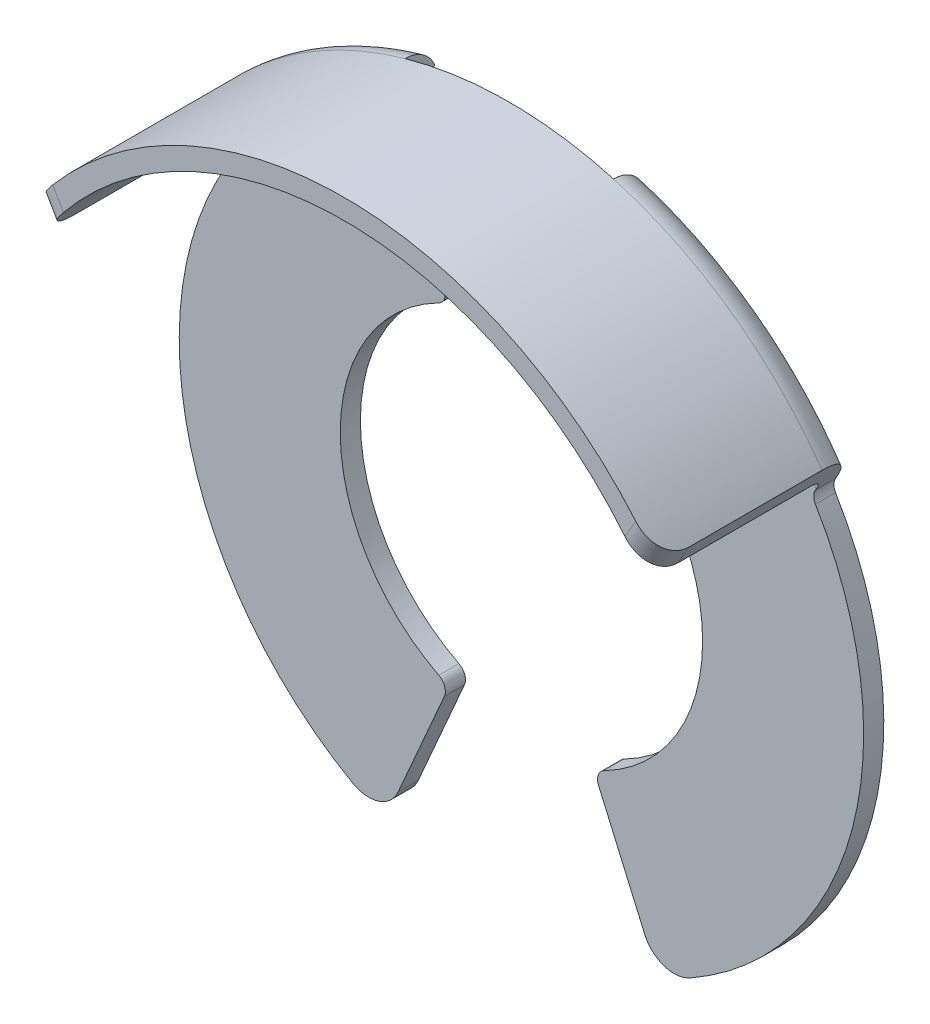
SolidWorks part; units mm, degrees
ref_plane "Front Plane" through (0, 0, 0) normal (0, 0, 1) x (1, 0, 0)
ref_plane "Top Plane" through (0, 0, 0) normal (0, 1, 0) x (1, 0, 0)
ref_plane "Right Plane" through (0, 0, 0) normal (1, 0, 0) x (0, 0, -1)
sketch "Sketch1" plane through (0, 0, 0) normal (0, 0, 1) x (1, 0, 0)
  circle A0 centre (0, 0) radius 9
  circle A1 centre (0, 0) radius 19
  dimension "D1" = 18
  dimension "D2" = 38
extrude "Boss-Extrude1" add sketch "Sketch1" against normal blind 9.8
sketch "Sketch2" plane through (0, 0, 0) normal (0, 0, 1) x (1, 0, 0)
  circle A0 centre (0, 0) radius 18
  dimension "D1" = 36
extrude "Cut-Extrude1" cut sketch "Sketch2" against normal blind 8.8
sketch "Sketch3" plane through (0, 0, 0) normal (0, 0, 1) x (1, 0, 0)
  line L0 (-15.5387, 10.9338) -> (-14.4222, 9)
  line L1 (15.5387, 10.9338) -> (14.4222, 9)
  circle A0 centre (0, 0) radius 19 construction
  arc A1 (-14.4222, 9) -> (14.4222, 9) centre (0, 0) ccw
  circle A2 centre (0, 0) radius 9 construction
  arc A4 (-15.5387, 10.9338) -> (15.5387, 10.9338) centre (0, 0) ccw
  point P7 (-17, 0)
  point P9 (17, 0)
  point P10 (0, 9)
  dimension "D1" = 60
  dimension "D2" = 34
extrude "Cut-Extrude2" cut sketch "Sketch3" against normal through all
sketch "Sketch4" plane through (0, 0, -8.8) normal (0, 0, 1) x (1, 0, 0)
  line L0 (0, 0) -> (-3.5978, -8.2496) construction
  line L1 (0, 0) -> (3.5978, -8.2496) construction
  line L2 (-3.5978, 8.2496) -> (-6.5247, 14.9609)
  line L3 (0, 0) -> (-3.5978, 8.2496) construction
  line L4 (0, 0) -> (3.5978, 8.2496) construction
  line L5 (6.5247, 14.9609) -> (3.5978, 8.2496)
  line L6 (3.5978, 8.2496) -> (3.5978, -8.2496) construction
  line L7 (-3.5978, 8.2496) -> (-3.5978, -8.2496) construction
  line L8 (-3.5978, -8.2496) -> (-6.1229, -14.0396)
  line L9 (3.5978, -8.2496) -> (6.1229, -14.0396)
  arc A0 (5.5515, 17.1225) -> (-5.5515, 17.1225) centre (0, 0) ccw
  arc A1 (14.9843, 9.9735) -> (-14.9843, 9.9735) centre (0, 0) ccw construction
  arc A2 (-3.5978, 8.2496) -> (-3.5978, -8.2496) centre (0, 0) ccw
  circle A3 centre (0, 0) radius 9 construction
  arc A4 (-6.5247, 14.9609) -> (-5.5515, 17.1225) centre (-5.0581, 15.6005) cw
  arc A6 (5.5515, 17.1225) -> (6.5247, 14.9609) centre (5.0581, 15.6005) cw
  arc A7 (-6.1229, -14.0396) -> (-8.378, -14.7922) centre (-7.5895, -13.4) cw
  arc A8 (-14.4222, 9) -> (14.4222, 9) centre (0, 0) ccw construction
  arc A9 (6.1229, -14.0396) -> (8.378, -14.7922) centre (7.5895, -13.4) ccw
  arc A10 (8.378, -14.7922) -> (-8.378, -14.7922) centre (0, 0) cw
  arc A11 (15.5387, 10.9338) -> (-15.5387, 10.9338) centre (0, 0) ccw construction
  arc A12 (3.5978, -8.2496) -> (3.5978, 8.2496) centre (0, 0) ccw
  point P1 (-7.5895, -15)
  point P30 (7.5895, -15)
  point P31 (0, 19)
  dimension "D2" = 1.6
  dimension "D1" = 34
extrude "Cut-Extrude3" cut sketch "Sketch4" against normal up to vertex
fillet "Fillet1" radius 1.6 3 edges at (0, 19, -9.8) (15.2615, 10.4537, 0) (-15.2615, 10.4537, 0)
fillet "Fillet2" radius 0.6 8 edges at (10.8723, 14.3455, -8.8) (-10.8723, 14.3455, -8.8) (-3.5978, -8.2496, -9.3) (3.5978, -8.2496, -9.3) (-3.5978, 8.2496, -9.3) (3.5978, 8.2496, -9.3) (-14.4222, 9, -9.3) (14.4222, 9, -9.3)
sketch "Sketch5" plane through (0, -4.5, -9.8) normal (0, 0, 1) x (1, 0, 0)
  line L0 (-5.1774, 16.3716) -> (-5.1774, 23.5)
  line L5 (5.1774, 16.3716) -> (5.1774, 23.5)
  line L6 (5.1774, 16.3716) -> (-5.1774, 16.3716)
  line L7 (3.8301, 13.2824) -> (6.5247, 19.4609) construction
  line L8 (-6.5247, 19.4609) -> (-3.8301, 13.2824) construction
  line L10 (-5.1774, 23.5) -> (5.1774, 23.5)
  arc A0 (15.5387, 15.4338) -> (-15.5387, 15.4338) centre (0, 4.5) ccw construction
extrude "Cut-Extrude5" cut sketch "Sketch5" along normal blind 1.6
